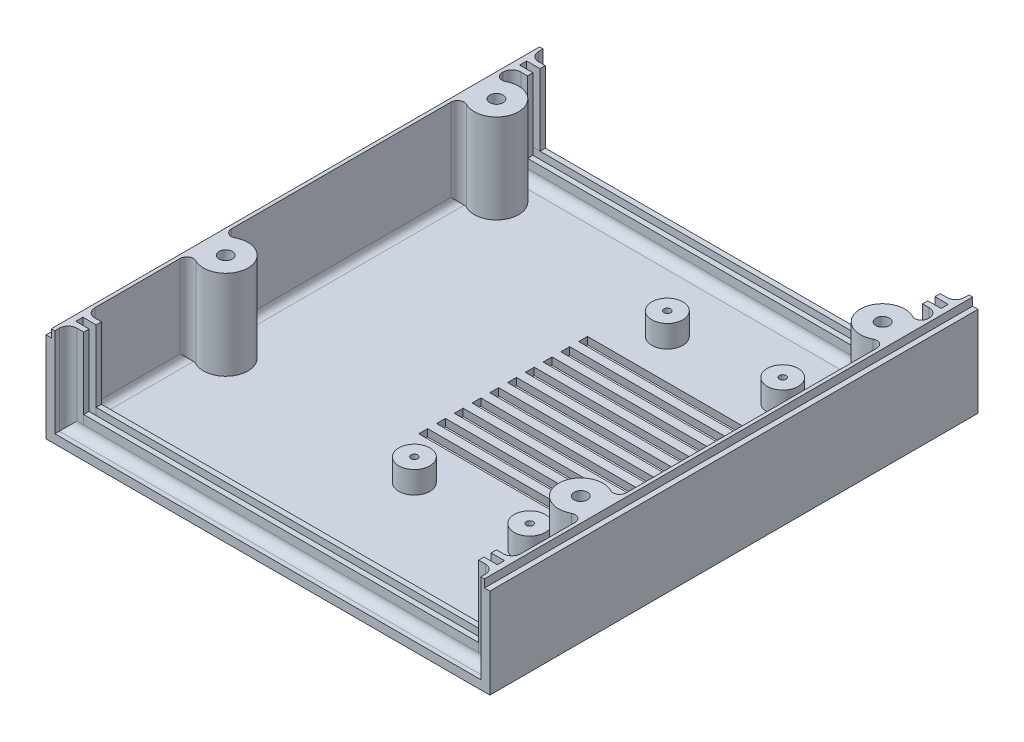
SolidWorks part; units mm, degrees
ref_plane "Спереди" through (0, 0, 0) normal (0, 0, 1) x (1, 0, 0)
ref_plane "Сверху" through (0, 0, 0) normal (0, 1, 0) x (1, 0, 0)
ref_plane "Справа" through (0, 0, 0) normal (1, 0, 0) x (0, 0, -1)
sketch "Эскиз1" plane through (0, 0, 0) normal (0, 1, 0) x (1, 0, 0)
  line L1 (-50, 55) -> (50, 55)
  line L2 (-50, 55) -> (-50, -55)
  line L3 (-50, -55) -> (50, -55)
  line L4 (50, 55) -> (50, -55)
  line L5 (-50, 55) -> (50, -55) construction
  line L6 (-50, -55) -> (50, 55) construction
  point P0 (0, 0)
  dimension "D1" = 110
  dimension "D2" = 100
extrude "Бобышка-Вытянуть1" add sketch "Эскиз1" along normal blind 22.1
sketch "Эскиз2" plane through (0, 22.1, 0) normal (0, 1, 0) x (1, 0, 0)
  line L0 (-48, 46) -> (-48, -46)
  line L1 (-46, -48) -> (-44.5, -48)
  line L2 (-44.5, -48) -> (-44.5, -49.2)
  line L3 (-44.5, -49.2) -> (-47.5, -49.2)
  line L4 (-47.5, -49.2) -> (-47.5, -50.8)
  line L5 (-47.5, -50.8) -> (-44.5, -50.8)
  line L6 (-44.5, -50.8) -> (-44.5, -52)
  line L7 (-44.5, -52) -> (-46, -52)
  line L8 (-48, -54) -> (-48, -55)
  line L9 (-50, -55) -> (50, -55) construction
  line L10 (0, 0) -> (-46.9941, 0) construction
  line L11 (-50, 55) -> (-50, -55) construction
  line L12 (0, 51.0945) -> (0, -54.7154) construction
  line L13 (-48, 54) -> (-48, 55)
  line L14 (-44.5, 52) -> (-46, 52)
  line L15 (-44.5, 50.8) -> (-44.5, 52)
  line L16 (-47.5, 50.8) -> (-44.5, 50.8)
  line L17 (-47.5, 49.2) -> (-47.5, 50.8)
  line L18 (-44.5, 49.2) -> (-47.5, 49.2)
  line L19 (-44.5, 48) -> (-44.5, 49.2)
  line L20 (-46, 48) -> (-44.5, 48)
  line L21 (46, 48) -> (44.5, 48)
  line L22 (44.5, 48) -> (44.5, 49.2)
  line L23 (44.5, 49.2) -> (47.5, 49.2)
  line L24 (47.5, 49.2) -> (47.5, 50.8)
  line L25 (47.5, 50.8) -> (44.5, 50.8)
  line L26 (44.5, 50.8) -> (44.5, 52)
  line L27 (44.5, 52) -> (46, 52)
  line L28 (48, 54) -> (48, 55)
  line L29 (48, -54) -> (48, -55)
  line L30 (44.5, -52) -> (46, -52)
  line L31 (44.5, -50.8) -> (44.5, -52)
  line L32 (47.5, -50.8) -> (44.5, -50.8)
  line L33 (47.5, -49.2) -> (47.5, -50.8)
  line L34 (44.5, -49.2) -> (47.5, -49.2)
  line L35 (44.5, -48) -> (44.5, -49.2)
  line L36 (46, -48) -> (44.5, -48)
  line L37 (48, 46) -> (48, -46)
  line L38 (-48, 55) -> (48, 55)
  line L39 (-48, -55) -> (48, -55)
  arc A0 (-48, -54) -> (-46, -52) centre (-46, -54) cw
  arc A1 (-48, -46) -> (-46, -48) centre (-46, -46) ccw
  arc A2 (-48, 46) -> (-46, 48) centre (-46, 46) cw
  arc A3 (-48, 54) -> (-46, 52) centre (-46, 54) ccw
  arc A4 (48, 54) -> (46, 52) centre (46, 54) cw
  arc A5 (48, 46) -> (46, 48) centre (46, 46) ccw
  arc A6 (48, -46) -> (46, -48) centre (46, -46) cw
  arc A7 (48, -54) -> (46, -52) centre (46, -54) ccw
  point P23 (-48, -52)
  point P39 (-48, 0)
  point P52 (48, 0)
  dimension "D6" = 2
  dimension "D7" = 2
  dimension "D1" = 2
  dimension "D2" = 1.2
  dimension "D3" = 1.2
  dimension "D4" = 1.6
  dimension "D5" = 3
  dimension "D8" = 2.5
  dimension "D9" = 3
extrude "Вырез-Вытянуть1" cut sketch "Эскиз2" against normal offset from surface (20.1 mm away) 2
sketch "Эскиз3" plane through (0, 0, 0) normal (1, 0, 0) x (0, 0, -1)
  line L0 (47.9992, 4) -> (47.9992, 6)
  line L1 (47.9992, 6) -> (49.1992, 6)
  line L2 (49.1992, 6) -> (49.1992, 3)
  line L3 (49.1992, 3) -> (50.7992, 3)
  line L4 (50.7992, 3) -> (50.7992, 6)
  line L5 (50.7992, 6) -> (51.9992, 6)
  line L6 (51.9992, 6) -> (51.9992, 4)
  line L7 (45.9992, 2) -> (53.9992, 2)
  line L8 (55, 22.1) -> (55, 0) construction
  line L9 (-55, 0) -> (55, 0) construction
  line L11 (0, 0) -> (0, 14.4735) construction
  line L12 (-45.9992, 2) -> (-53.9992, 2)
  line L13 (-51.9992, 6) -> (-51.9992, 4)
  line L14 (-50.7992, 6) -> (-51.9992, 6)
  line L15 (-50.7992, 3) -> (-50.7992, 6)
  line L16 (-49.1992, 3) -> (-50.7992, 3)
  line L17 (-49.1992, 6) -> (-49.1992, 3)
  line L18 (-47.9992, 6) -> (-49.1992, 6)
  line L19 (-47.9992, 4) -> (-47.9992, 6)
  arc A0 (53.9992, 2) -> (51.9992, 4) centre (53.9992, 4) cw
  arc A1 (45.9992, 2) -> (47.9992, 4) centre (45.9992, 4) ccw
  arc A2 (-45.9992, 2) -> (-47.9992, 4) centre (-45.9992, 4) cw
  arc A3 (-53.9992, 2) -> (-51.9992, 4) centre (-53.9992, 4) ccw
  dimension "D1" = 2
  dimension "D2" = 2
  dimension "D3" = 3
  dimension "D4" = 3
  dimension "D5" = 2
  dimension "D6" = 2
  dimension "D7" = 1.2
  dimension "D8" = 1.2
  dimension "D9" = 3
  dimension "D10" = 1.6
  dimension "D11" = 3.0008
  dimension "D12" = 1.6
  dimension "D13" = 2
  dimension "D14" = 2
extrude "Бобышка-Вытянуть2" add sketch "Эскиз3" along normal up to surface and the other way up to surface
sketch "Эскиз5" plane through (0, 2, 0) normal (0, 1, 0) x (1, 0, 0)
  line L0 (46.0562, 47.9992) -> (-46.0562, 47.9992) construction
  line L1 (48, 45.9992) -> (48, -45.9992) construction
  circle A0 centre (28, 32.9992) radius 3.5
  circle A1 centre (2, 32.9992) radius 3.5
  circle A2 centre (2, -24.0008) radius 3.5
  circle A3 centre (28, -24.0008) radius 3.5
  circle A4 centre (2, 32.9992) radius 0.75
  circle A5 centre (28, 32.9992) radius 0.75
  circle A6 centre (28, -24.0008) radius 0.75
  circle A7 centre (2, -24.0008) radius 0.75
  dimension "D1" = 7
  dimension "D4" = 15
  dimension "D6" = 1.5
  dimension "D2" = 57
  dimension "D3" = 26
  dimension "D5" = 20
extrude "Стойки платы" add sketch "Эскиз5" along normal blind 5
sketch "Эскиз6" plane through (0, 0, 55) normal (0, 0, 1) x (1, 0, 0)
  line L0 (0, 0) -> (0, 43.7709) construction
  line L3 (-50, 22.1) -> (-48.8, 22.1)
  line L4 (-50, 22.1) -> (-50, 20.3)
  line L5 (-50, 20.3) -> (-48.8, 20.3)
  line L6 (-48.8, 22.1) -> (-48.8, 20.3)
  dimension "D1" = 1.2
  dimension "D2" = 1.8
extrude "Вырез-Вытянуть2" cut sketch "Эскиз6" against normal through all
mirror "Зеркальное отражение1" about plane through (0, 0, 0) normal (1, 0, 0) of "Вырез-Вытянуть2"
sketch "Эскиз8" plane through (0, 2, 0) normal (0, 1, 0) x (1, 0, 0)
  line L0 (48, -46) -> (48, 46) construction
  line L1 (-7, 23.9992) -> (38, 23.9992)
  line L2 (-7, 23.9992) -> (-7, 21.9992)
  line L3 (-7, 21.9992) -> (38, 21.9992)
  line L4 (38, 23.9992) -> (38, 21.9992)
  circle A0 centre (28, 32.9992) radius 3.5 construction
  dimension "D1" = 10
  dimension "D2" = 45
  dimension "D3" = 2
  dimension "D4" = 9
extrude "Вырез-Вытянуть3" cut sketch "Эскиз8" against normal through all draft 10
pattern_linear "Линейный массив1" count 10 spacing 4 along (0, 0, 1) of "Вырез-Вытянуть3"
sketch "Эскиз9" plane through (0, 2, 0) normal (0, 1, 0) x (1, 0, 0)
  line L0 (0, -61.193) -> (0, 61.193) construction
  line L1 (-62.3332, 0) -> (62.3332, 0) construction
  line L2 (48, 45.9992) -> (-48, 45.9992) construction
  line L3 (48, -46) -> (48, 46) construction
  line L4 (48, -45.9992) -> (-48, -45.9992) construction
  circle A0 centre (-43.5, 39.9992) radius 5
  circle A1 centre (43.5, 39.9992) radius 5
  circle A2 centre (-43.5, -20.9992) radius 5
  circle A3 centre (43.5, -27.9992) radius 5
  point P11 (0, 0)
  point P17 (0, 0)
  dimension "D1" = 10
  dimension "D4" = 25
  dimension "D2" = 6
  dimension "D3" = 4.5
  dimension "D5" = 18
extrude "Бобышка-Вытянуть4" add sketch "Эскиз9" along normal up to surface (20.1 mm away)
sketch "Эскиз10" plane through (0, 0, 0) normal (0, -1, 0) x (1, 0, 0)
  circle A5 centre (-43.5, 20.9992) radius 3
  circle A6 centre (43.5, 27.9992) radius 3
  circle A7 centre (43.5, -39.9992) radius 3
  circle A8 centre (-43.5, -39.9992) radius 3
  dimension "D1" = 6
sketch "Эскиз11" plane through (0, 22.1, 0) normal (0, 1, 0) x (1, 0, 0)
  circle A0 centre (-43.5, -20.9992) radius 1.5
  circle A1 centre (-43.5, 39.9992) radius 1.5
  circle A2 centre (43.5, 39.9992) radius 1.5
  circle A3 centre (43.5, -27.9992) radius 1.5
  dimension "D1" = 3
extrude "Вырез-Вытянуть5" cut sketch "Эскиз11" against normal through all
fillet "Скругление4" radius 1.5 27 edges at (48, 12.05, 30.1787) (48, 12.05, 25.8198) (46.0562, 5, 47.9992) (48, 2, 45.9996) (48, 2, 38.0889) (-46.0562, 5, -47.9992) (-46.6151, 3.3874, -47.9031) (-48, 2, -45.9996) (-46.0562, 5, 47.9992) (-46.4011, 3.6028, 47.9594) (-48, 2, 45.9996) (46.0562, 5, -47.9992) (46.4576, 3.5458, -47.9469) (48, 2, -45.9996) (46.8884, 3.1132, 47.7919) (-48, 12.05, -42.1787) (-48, 12.05, -37.8198) (-48, 12.05, 18.8198) (-48, 12.05, 23.1787) (-48, 2, -44.0889) (-48, 2, -9.5) (-48, 2, 34.5889) (48, 12.05, -37.8198) (48, 12.05, -42.1787) (48, 2, -44.0889) (48, 2, -6) (38.5, 2, 27.9992)
extrude "Вырез-Вытянуть7" cut sketch "Эскиз10" against normal offset from surface (16.1 mm away) 6
